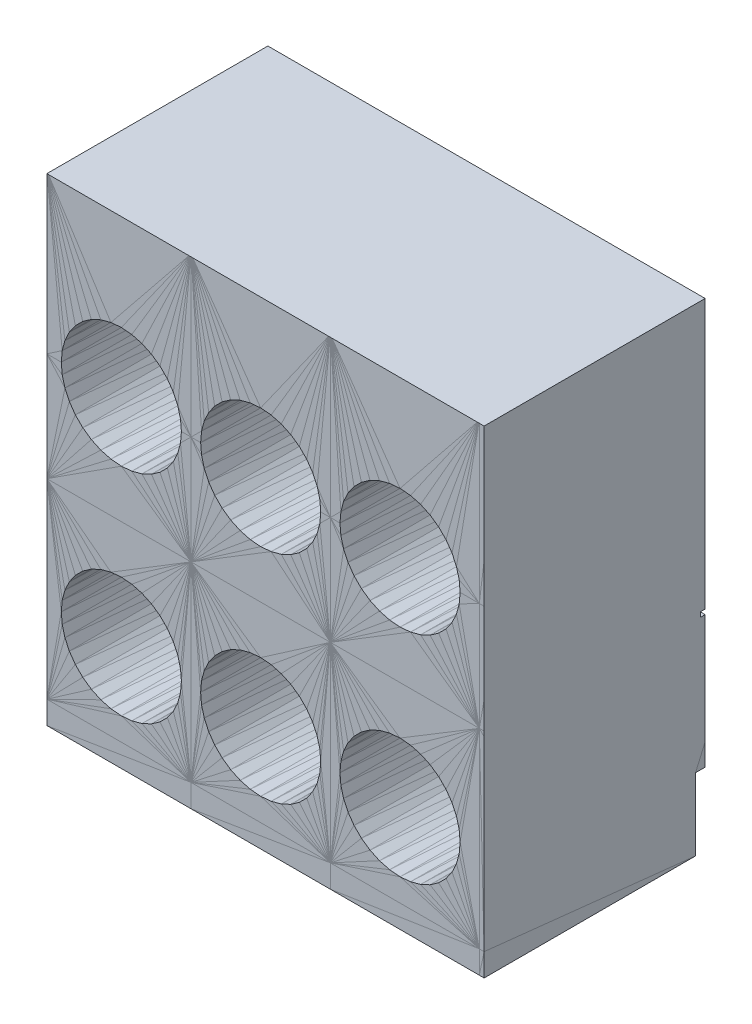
SolidWorks part; units mm, degrees
ref_plane "Front Plane" through (0, 0, 0) normal (0, 0, 1) x (1, 0, 0)
ref_plane "Top Plane" through (0, 0, 0) normal (0, 1, 0) x (1, 0, 0)
ref_plane "Right Plane" through (0, 0, 0) normal (1, 0, 0) x (0, 0, -1)
imported_body "Imported1"
sketch "Sketch1" plane through (0, 0, 0) normal (0, 0, 1) x (1, 0, 0)
  line L1 (-96.6205, 91.4923) -> (47.9995, 91.4923)
  line L2 (-96.6205, 91.4923) -> (-96.6205, 32.4825)
  line L3 (-96.6205, 32.4825) -> (47.9995, 32.4825)
  line L4 (47.9995, 91.4923) -> (47.9995, 32.4825)
extrude "Cut-Extrude1" cut sketch "Sketch1" against normal blind 50
sketch "Sketch2" plane through (30.1262, 0, 0) normal (1, 0, 0) x (0, 0, -1)
  line L6 (63.1721, 41.7194) -> (-13.4572, 41.7194)
  line L7 (63.1721, 41.7194) -> (63.1721, -33.184)
  line L8 (63.1721, -33.184) -> (-13.4572, -33.184)
  line L9 (-13.4572, 41.7194) -> (-13.4572, -33.184)
extrude "Cut-Extrude2" cut sketch "Sketch2" against normal up to vertex
